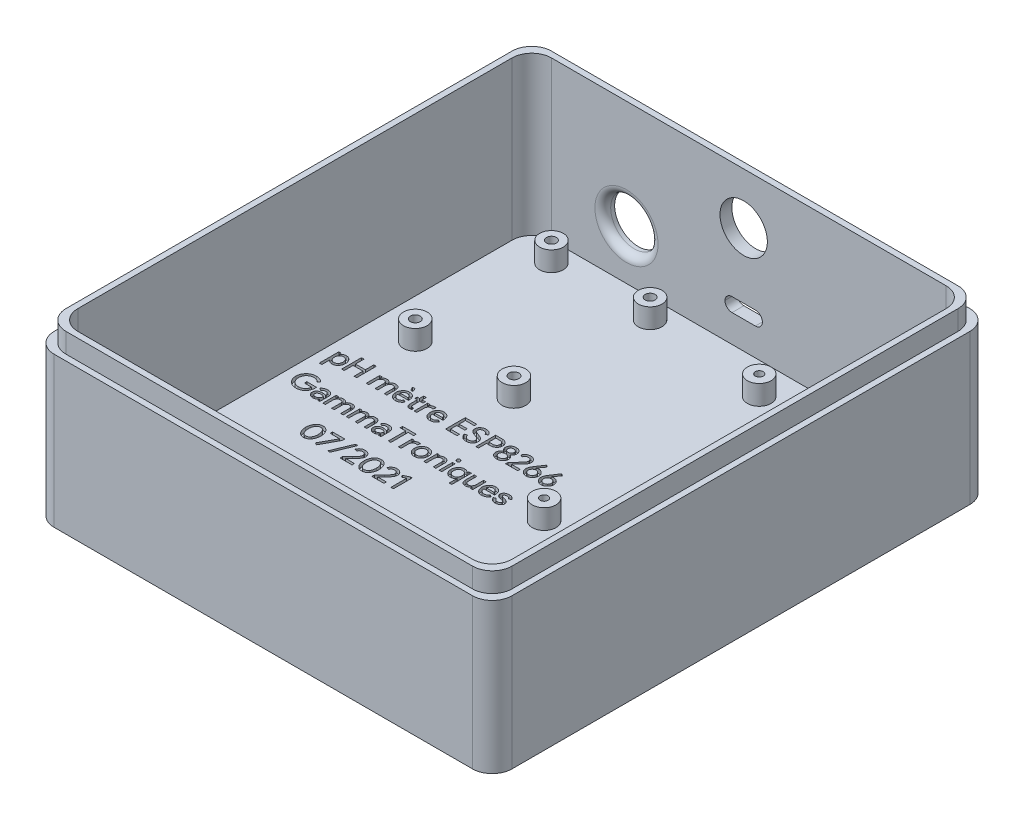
SolidWorks part; units mm, degrees
ref_plane "Front Plane" through (0, 0, 0) normal (0, 0, 1) x (1, 0, 0)
ref_plane "Top Plane" through (0, 0, 0) normal (0, 1, 0) x (1, 0, 0)
ref_plane "Right Plane" through (0, 0, 0) normal (1, 0, 0) x (0, 0, -1)
sketch "Sketch1" plane through (0, 0, 0) normal (0, 1, 0) x (1, 0, 0)
  line L1 (55, -60) -> (-55, -60)
  line L2 (55, -60) -> (55, 60)
  line L3 (55, 60) -> (-55, 60)
  line L4 (-55, -60) -> (-55, 60)
  line L5 (55, -60) -> (-55, 60) construction
  line L6 (55, 60) -> (-55, -60) construction
  point P0 (0, 0)
  dimension "D1" = 110
  dimension "D2" = 120
extrude "Boss-Extrude1" add sketch "Sketch1" along normal blind 40
shell "Shell1" thickness 3
sketch "Sketch2" plane through (0, 0, 0) normal (0, 1, 0) x (1, 0, 0)
  line L0 (-55, 60) -> (-55, -60) construction
  line L2 (55, 60) -> (-55, 60) construction
  line L3 (55, 60) -> (-55, 60) construction
  circle A0 centre (-45, 55) radius 3
  circle A1 centre (-45, 55) radius 1.25
  circle A2 centre (-20, 55) radius 3
  circle A3 centre (-20, 55) radius 1.25
  circle A4 centre (-20, 20.5) radius 3
  circle A5 centre (-20, 20.5) radius 1.25
  circle A6 centre (-45, 20.5) radius 3
  circle A7 centre (-45, 20.5) radius 1.25
  circle A8 centre (10.64, 52) radius 1
  circle A9 centre (10.64, 52) radius 3
  circle A10 centre (45.14, 52) radius 3
  circle A11 centre (45.14, 52) radius 1
  circle A12 centre (45.14, -2.5) radius 3
  circle A13 centre (45.14, -2.5) radius 1
  circle A14 centre (10.64, -2.5) radius 3
  circle A15 centre (10.64, -2.5) radius 1
  dimension "D1" = 6
  dimension "D2" = 2.5
  dimension "D5" = 10
  dimension "D6" = 25
  dimension "D7" = 2
  dimension "D8" = 6
  dimension "D11" = 5
  dimension "D12" = 8
  dimension "D13" = 34.5
  dimension "D3" = 2
  dimension "D4" = 2
  dimension "D9" = 2
  dimension "D10" = 2
extrude "Boss-Extrude2" add sketch "Sketch2" along normal blind 5
sketch "Sketch3" plane through (0, 0, -63) normal (0, 0, -1) x (-1, 0, 0)
  line L1 (58, -3) -> (31, -3)
  line L2 (58, -3) -> (58, 12.6)
  line L3 (58, 12.6) -> (31, 12.6)
  line L4 (31, -3) -> (31, 12.6)
  circle A0 centre (31, 12.6) radius 6
  dimension "D2" = 12
  dimension "D1" = 15.6
  dimension "D3" = 27
extrude "Cut-Extrude1" cut sketch "Sketch3" against normal blind 5 contours L3 A0 L4 | L4 A0 L3
fillet "Fillet2" radius 2 1 edges at (-25, 12.6, -60)
sketch "Sketch4" plane through (0, 0, -63) normal (0, 0, -1) x (-1, 0, 0)
  line L0 (-58, -3) -> (58, -3) construction
  line L2 (6.0565, 7) -> (-3.4435, 7)
  line L3 (6.0565, 7) -> (6.0565, 10.5)
  line L4 (6.0565, 10.5) -> (-3.4435, 10.5)
  line L5 (-3.4435, 7) -> (-3.4435, 10.5)
  line L6 (6.0565, 7) -> (-3.4435, 10.5) construction
  line L7 (6.0565, 10.5) -> (-3.4435, 7) construction
  point P3 (1.3065, 8.75)
  dimension "D1" = 9.5
  dimension "D2" = 3.5
  dimension "D3" = 10
extrude "Cut-Extrude2" cut sketch "Sketch4" against normal blind 10
fillet "Fillet3" radius 1.8 4 edges at (-6.0565, 7, -61.5) (3.4435, 7, -61.5) (-6.0565, 10.5, -61.5) (3.4435, 10.5, -61.5)
sketch "Sketch5" plane through (0, 0, -63) normal (0, 0, -1) x (-1, 0, 0)
  text T0 "5V 2A" font "Product Sans" height 5
  point P1 (-7.1816, 2.4972)
  point P2 (0, 0)
  point P3 (-7.3801, 0.5118)
  point P4 (0, 0)
extrude "Cut-Extrude3" cut sketch "Sketch5" against normal blind 1
sketch "Sketch7" plane through (0, 40, 0) normal (0, 1, 0) x (1, 0, 0)
  line L0 (-58, 63) -> (58, -63) construction
  line L1 (-58, 63) -> (58, 63)
  line L2 (-58, 63) -> (-58, -63)
  line L3 (-58, -63) -> (58, -63)
  line L4 (58, 63) -> (58, -63)
  line L5 (-58, -63) -> (58, 63) construction
  line L7 (56.5, -61.5) -> (-56.5, -61.5)
  line L8 (56.5, -61.5) -> (56.5, 61.5)
  line L9 (56.5, 61.5) -> (-56.5, 61.5)
  line L10 (-56.5, -61.5) -> (-56.5, 61.5)
  line L11 (56.5, -61.5) -> (-56.5, 61.5) construction
  line L12 (56.5, 61.5) -> (-56.5, -61.5) construction
  point P7 (0, 0)
  dimension "D1" = 116
  dimension "D2" = 126
  dimension "D3" = 113
  dimension "D4" = 123
extrude "Cut-Extrude4" cut sketch "Sketch7" against normal blind 5
fillet "Fillet1" radius 5 12 edges at (58, 16, -63) (58, 16, 63) (-58, 16, 63) (-58, 16, -63) (-55, 20, -60) (-55, 20, 60) (55, 20, -60) (55, 20, 60) (-56.5, 37.5, -61.5) (56.5, 37.5, -61.5) (56.5, 37.5, 61.5) (-56.5, 37.5, 61.5)
sketch "Sketch8" plane through (0, 0, 0) normal (0, 1, 0) x (1, 0, 0)
  text T0 "pH mètre ESP8266  GammaTroniques               07/2021" font "Product Sans" height 5
extrude "Cut-Extrude5" cut sketch "Sketch8" against normal blind 1
sketch "Sketch9" plane through (0, 0, -63) normal (0, 0, -1) x (-1, 0, 0)
  line L0 (-53, -3) -> (53, -3) construction
  circle A0 centre (1.3065, 27) radius 6
  dimension "D1" = 12
  dimension "D2" = 30
extrude "Cut-Extrude6" cut sketch "Sketch9" against normal blind 100
sketch "Sketch11" plane through (0, 0, -63) normal (0, 0, -1) x (-1, 0, 0)
  text T0 "°C" font "Product Sans" height 5
  point P1 (0, 0)
  point P2 (0, 0)
  point P3 (0, 0)
  point P4 (-3.4378, 15.0668)
  point P5 (0, 0)
  point P6 (0, 0)
  point P7 (-2.7399, 15.4013)
  point P8 (-2.4981, 14.3218)
extrude "Cut-Extrude7" cut sketch "Sketch11" against normal blind 1
sketch "Sketch12" plane through (0, 0, -63) normal (0, 0, -1) x (-1, 0, 0)
  text T0 "pH" font "Product Sans" height 5
extrude "Cut-Extrude8" cut sketch "Sketch12" against normal blind 1
